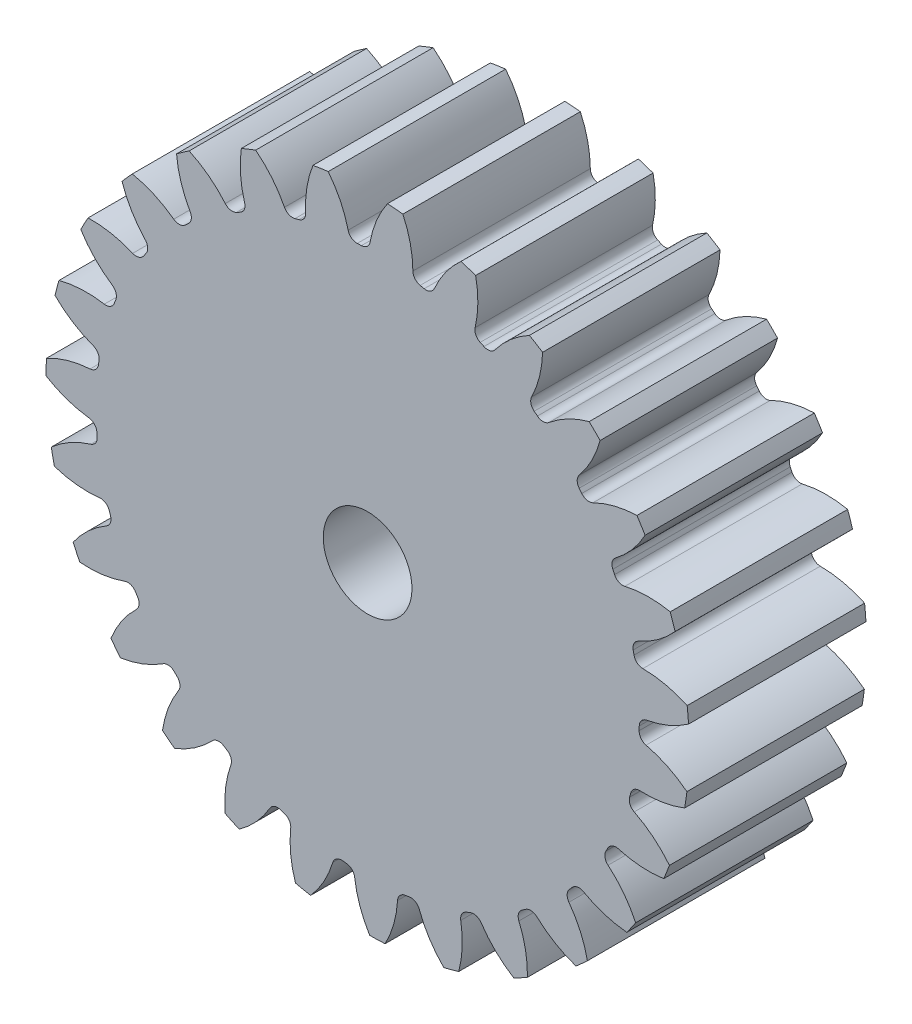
SolidWorks part; units mm, degrees
ref_plane "Front" through (0, 0, 0) normal (0, 0, 1) x (1, 0, 0)
ref_plane "Top" through (0, 0, 0) normal (0, 1, 0) x (1, 0, 0)
ref_plane "Right" through (0, 0, 0) normal (1, 0, 0) x (0, 0, -1)
sketch "Sketch3" plane through (0, 0, 0) normal (0, 0, 1) x (1, 0, 0)
  circle A0 centre (0, 0) radius 184.15
  dimension "od" = 368.3
extrude "gearBody" add sketch "Sketch3" along normal blind 101.6
sketch "Sketch2" plane through (0, 0, 0) normal (0, 0, 1) x (1, 0, 0)
  line L0 (0, 0) -> (148.8465, 61.6542) construction
  line L1 (183.1947, -22.3412) -> (0, 0) construction
  line L2 (0, 0) -> (36.3143, 0) construction
  line L3 (171.3712, 5.1978) -> (170.8213, -14.6694) construction
  line L5 (171.0962, -4.7358) -> (0, 0) construction
  line L7 (0, 0) -> (161.1103, 0) construction
  arc A0 (161.0964, 2.1174) -> (160.7326, -11.0254) centre (0, 0) ccw construction
  arc A1 (183.765, 11.901) -> (182.8254, -22.0479) centre (0, 0) ccw construction
  arc A2 (171.3712, 5.1978) -> (170.8213, -14.6694) centre (0, 0) ccw construction
  arc A3 (155.4781, -5.4899) -> (155.5437, -3.119) centre (0, 0) ccw
  arc A4 (183.1947, -22.3412) -> (159.4341, -10.6976) centre (145.2082, -69.7934) ccw
  arc A5 (183.1947, -22.3412) -> (184.15, 12.1734) centre (0, 0) ccw
  arc A6 (184.15, 12.1734) -> (159.7817, 1.862) centre (148.8465, 61.6542) cw
  arc A7 (155.5437, -3.119) -> (159.7817, 1.862) centre (160.7116, -3.2226) cw
  arc A8 (159.4341, -10.6976) -> (155.4781, -5.4899) centre (160.6438, -5.6723) cw
  point P6 (184.15, 12.1734)
  point P22 (183.1947, -22.3412)
  dimension "baseDia" = 322.2206
  dimension "od" = 368.3
  dimension "pd" = 342.9
  dimension "rd" = 311.15
  dimension "rFillet" = 5.1689
  dimension "pointX" = 184.15
  dimension "pointY" = 12.1734
  dimension "CTT" = 19.8672
  dimension "flankCenterAngle" = 22.5
extrude "toothCut" cut sketch "Sketch2" along normal through all
pattern_circular "CirPattern1" count 27 over 360 about axis through (0, 0, 0) along (0, 0, 1) of "toothCut"
sketch "hub1Dia" plane through (0, 0, 0) normal (0, 0, -1) x (-1, 0, 0)
  circle A0 centre (0, 0) radius 12.7
  dimension "hub1Dia" = 25.4
sketch "hub2Dia" plane through (0, 0, 101.6) normal (0, 0, 1) x (1, 0, 0)
  circle A0 centre (0, 0) radius 12.7
  dimension "hub2dia" = 25.4
sketch "boreDia" plane through (0, 0, 0) normal (0, 0, 1) x (1, 0, 0)
  circle A0 centre (0, 0) radius 25.4
  dimension "boreDia" = 50.8
extrude "bore" cut sketch "boreDia" against normal mid plane 25400
